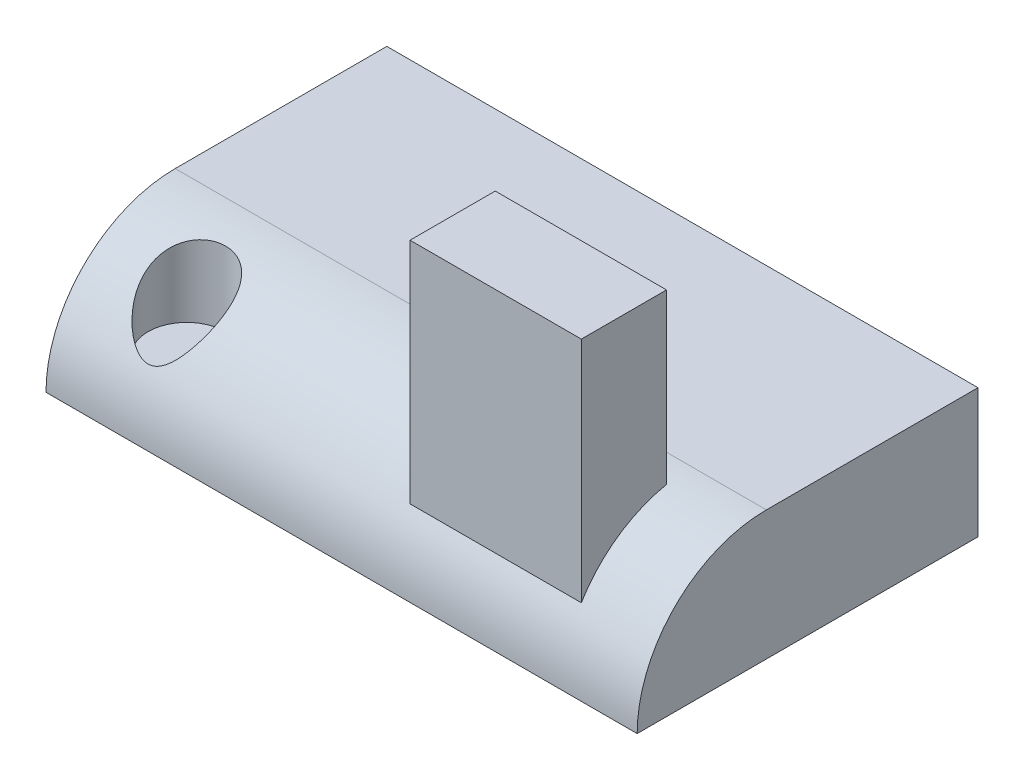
SolidWorks part; units mm, degrees
ref_plane "Front Plane" through (0, 0, 0) normal (0, 0, 1) x (1, 0, 0)
ref_plane "Top Plane" through (0, 0, 0) normal (0, 1, 0) x (1, 0, 0)
ref_plane "Right Plane" through (0, 0, 0) normal (1, 0, 0) x (0, 0, -1)
sketch "Sketch1" plane through (0, 0, 0) normal (0, -1, 0) x (1, 0, 0)
  line L1 (-73.6264, 33.3439) -> (77.4812, 33.3439)
  line L2 (-73.6264, 33.3439) -> (-73.6264, -53.7743)
  line L3 (-73.6264, -53.7743) -> (77.4812, -53.7743)
  line L4 (77.4812, 33.3439) -> (77.4812, -53.7743)
extrude "Boss-Extrude1" add sketch "Sketch1" along normal mid plane 33.02
sketch "Sketch2" plane through (0, 16.51, 0) normal (0, 1, 0) x (1, 0, 0)
  line L1 (58.4481, -28.5849) -> (14.6677, -28.5849)
  line L2 (58.4481, -28.5849) -> (58.4481, -6.8105)
  line L3 (58.4481, -6.8105) -> (14.6677, -6.8105)
  line L4 (14.6677, -28.5849) -> (14.6677, -6.8105)
extrude "Boss-Extrude2" add sketch "Sketch2" along normal blind 42.418
sketch "Sketch3" plane through (0, 16.51, 0) normal (0, 1, 0) x (1, 0, 0)
  circle A0 centre (-51.3938, -19.5836) radius 9.9147
extrude "Cut-Extrude1" cut sketch "Sketch3" against normal blind 20.32
fillet "Fillet1" radius 33.02 1 edges at (1.9274, 16.51, 33.3439)
